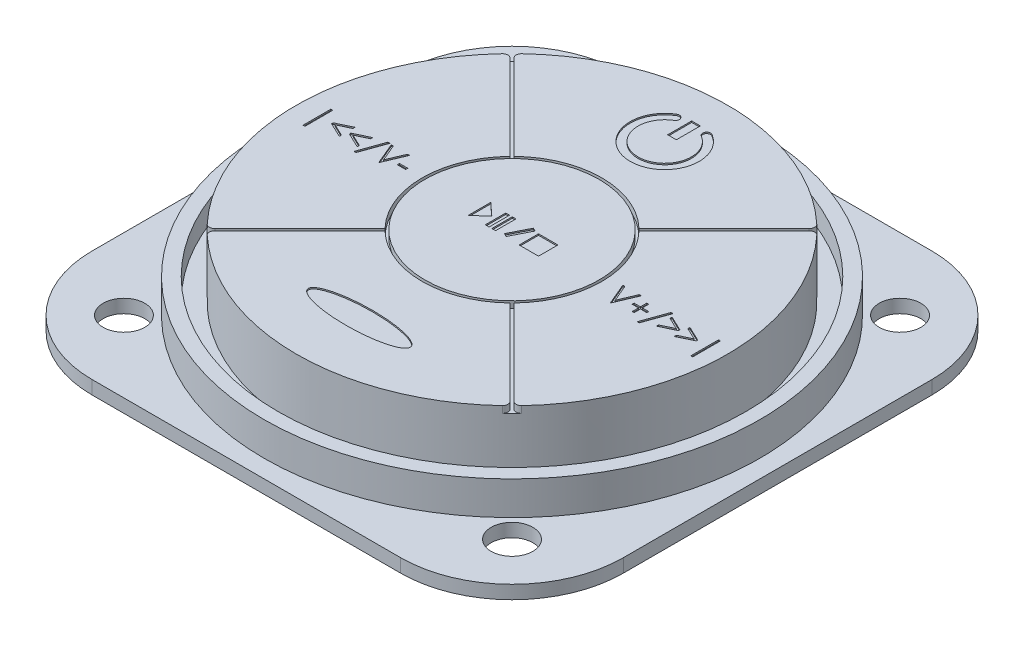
SolidWorks part; units mm, degrees
other "<Chip-PIC18F14K50>-<Imported1>"
ref_plane "Front Plane" through (0, 0, 0) normal (0, 0, 1) x (1, 0, 0)
ref_plane "Top Plane" through (0, 0, 0) normal (0, 1, 0) x (1, 0, 0)
ref_plane "Right Plane" through (0, 0, 0) normal (1, 0, 0) x (0, 0, -1)
sketch "Sketch2" plane through (0, 0, 0) normal (0, 1, 0) x (1, 0, 0)
  line L0 (-25.165, 14.6132) -> (-25.165, -14.6132)
  line L1 (-14.6132, -25.165) -> (14.6132, -25.165)
  line L2 (25.1651, -14.6132) -> (25.1651, 14.6132)
  line L3 (14.6132, 25.165) -> (-14.6132, 25.165)
  line L4 (-25.165, 0) -> (0, 0) construction
  line L5 (0, 0) -> (25.1651, 0) construction
  line L6 (0, 0) -> (0, 25.165) construction
  line L7 (0, 0) -> (0, -25.165) construction
  line L8 (-14.6132, 25.165) -> (-25.165, 14.6132) construction
  arc A0 (-25.165, -14.6132) -> (-14.6132, -25.165) centre (-14.6132, -14.6132) ccw
  arc A1 (14.6132, -25.165) -> (25.1651, -14.6132) centre (14.6132, -14.6132) ccw
  arc A2 (25.1651, 14.6132) -> (14.6132, 25.165) centre (14.6132, 14.6132) ccw
  arc A3 (-14.6132, 25.165) -> (-25.165, 14.6132) centre (-14.6132, 14.6132) ccw
  dimension "D1" = 50.3301
  dimension "D2" = 50.3301
  dimension "D3" = 14.9225
extrude "Boss-Extrude2" add sketch "Sketch2" along normal blind 1.27
sketch "Sketch9" plane through (0, 1.27, 0) normal (0, 1, 0) x (1, 0, 0)
  circle A0 centre (0, 0) radius 23.4823
  dimension "D1" = 46.9646
extrude "Boss-Extrude9" add sketch "Sketch9" along normal blind 7.0231
sketch "Sketch16" plane through (0, 8.2931, 0) normal (0, 1, 0) x (1, 0, 0)
  circle A0 centre (0, 0) radius 20.4279
  circle A1 centre (0, 0) radius 23.4823 construction
  circle A2 centre (0, 0) radius 23.4823
  dimension "D1" = 40.8559
extrude "Cut-Extrude7" cut sketch "Sketch16" against normal blind 3.8481
sketch "Sketch17" plane through (0, 4.445, 0) normal (0, 1, 0) x (1, 0, 0)
  circle A0 centre (0, 0) radius 20.4279 construction
  circle A1 centre (0, 0) radius 20.4279
  circle A2 centre (0, 0) radius 22.1615
  circle A3 centre (0, 0) radius 23.4823 construction
  dimension "D1" = 1.3208
extrude "Cut-Extrude8" cut sketch "Sketch17" against normal blind 2.032
sketch "Sketch10" plane through (0, 8.2931, 0) normal (0, 1, 0) x (1, 0, 0)
  line L0 (0, 0) -> (-6.0161, 6.0161) construction
  line L1 (0, 0) -> (6.0161, -6.0161) construction
  line L2 (0, 0) -> (6.0161, 6.0161) construction
  line L3 (0, 0) -> (-6.0161, -6.0161) construction
  line L4 (0, 0) -> (0, -8.255) construction
  line L5 (-6.0161, 6.0161) -> (-6.1059, 5.9263) construction
  line L6 (-6.0161, 6.0161) -> (-5.9263, 6.1059) construction
  line L7 (6.0161, 6.0161) -> (5.9263, 6.1059) construction
  line L8 (6.0161, 6.0161) -> (6.1059, 5.9263) construction
  line L9 (-6.0161, -6.0161) -> (-6.1059, -5.9263) construction
  line L10 (-6.0161, -6.0161) -> (-5.9263, -6.1059) construction
  line L11 (6.0161, -6.0161) -> (5.9263, -6.1059) construction
  line L12 (6.0161, -6.0161) -> (6.1059, -5.9263) construction
  line L13 (-6.1059, 5.9263) -> (-14.5343, 14.3547)
  line L14 (-5.9263, 6.1059) -> (-14.3547, 14.5343)
  line L15 (5.9263, 6.1059) -> (14.3547, 14.5343)
  line L16 (6.1059, 5.9263) -> (14.5343, 14.3547)
  line L17 (6.1059, -5.9263) -> (14.5343, -14.3547)
  line L18 (5.9263, -6.1059) -> (14.3547, -14.5343)
  line L20 (-6.1059, -5.9263) -> (-14.5343, -14.3547)
  line L21 (-5.9263, -6.1059) -> (-14.3547, -14.5343)
  circle A0 centre (0, 0) radius 20.4279 construction
  circle A1 centre (0, 0) radius 8.255
  circle A2 centre (0, 0) radius 8.509
  arc A3 (-14.5343, 14.3547) -> (-14.5343, -14.3547) centre (0, 0) ccw
  arc A4 (14.3547, 14.5343) -> (-14.3547, 14.5343) centre (0, 0) ccw
  arc A5 (14.5343, -14.3547) -> (14.5343, 14.3547) centre (0, 0) ccw
  arc A6 (-14.3547, -14.5343) -> (14.3547, -14.5343) centre (0, 0) ccw
  circle A7 centre (0, 0) radius 20.4279 construction
  circle A8 centre (0, 0) radius 20.4279
  dimension "D1" = 45
  dimension "D2" = 16.51
  dimension "D4" = 0.254
  dimension "D3" = 0.254
extrude "Cut-Extrude9" cut sketch "Sketch10" against normal blind 0.635 contours A2 L14 L13 M6 | A2 A1 | A2 L16 L15 M6 | A2 L18 L17 M6 | A2 L20 L21 M6
fillet "Fillet1" radius 0.508 8 edges at (-14.3547, 7.9756, -14.5343) (-14.5343, 7.9756, -14.3547) (14.5343, 7.9756, -14.3547) (14.3547, 7.9756, -14.5343) (14.3547, 7.9756, 14.5343) (14.5343, 7.9756, 14.3547) (-14.3547, 7.9756, 14.5343) (-14.5343, 7.9756, 14.3547)
sketch "Sketch11" plane through (0, 8.2931, 0) normal (0, 1, 0) x (1, 0, 0)
  line L0 (0, 0) -> (2.5129, 0) construction
  line L1 (1.595, 0.9179) -> (3.4308, 0.9179)
  line L2 (1.595, 0.9179) -> (1.595, -0.9179)
  line L3 (1.595, -0.9179) -> (3.4308, -0.9179)
  line L4 (3.4308, 0.9179) -> (3.4308, -0.9179)
  line L5 (1.595, 0.9179) -> (3.4308, -0.9179) construction
  line L6 (1.595, -0.9179) -> (3.4308, 0.9179) construction
  line L7 (1.2025, 0.9769) -> (0.2822, -0.841)
  line L8 (0.2822, -0.841) -> (-0.0301, -0.6829)
  line L9 (-0.0301, -0.6829) -> (0.8902, 1.135)
  line L10 (0.8902, 1.135) -> (1.2025, 0.9769)
  line L11 (-2.0739, 0.1579) -> (-3.2464, 1.2336)
  line L12 (-0.695, 1.0699) -> (-1.0454, 1.0699)
  line L13 (-0.695, 1.0699) -> (-0.695, -0.8627)
  line L14 (-0.695, -0.8627) -> (-1.0454, -0.8627)
  line L15 (-1.0454, 1.0699) -> (-1.0454, -0.8627)
  line L16 (-1.303, 1.0699) -> (-1.666, 1.0699)
  line L17 (-1.303, 1.0699) -> (-1.303, -0.8627)
  line L18 (-1.303, -0.8627) -> (-1.666, -0.8627)
  line L19 (-1.666, 1.0699) -> (-1.666, -0.8627)
  line L20 (-3.2464, 1.2336) -> (-3.2464, -0.9179)
  line L21 (-3.2464, -0.9179) -> (-2.0739, 0.1579)
  line L22 (0, 8.509) -> (0, 20.4279) construction
  line L23 (-1.2885, 16.6447) -> (0, 14.4685) construction
  line L24 (0, 14.4685) -> (1.2885, 16.6447) construction
  line L25 (1.666, 17.2822) -> (-1.666, 17.2822) construction
  line L26 (-1.666, 17.2822) -> (-1.2885, 16.6447) construction
  line L27 (1.666, 17.2822) -> (1.2885, 16.6447) construction
  line L28 (0, -8.509) -> (0, -20.4279) construction
  line L29 (-0.4103, 15.1614) -> (0.4103, 15.1614)
  line L30 (-0.4103, 15.1614) -> (-0.4103, 17.4347)
  line L31 (-0.4103, 17.4347) -> (0.4103, 17.4347)
  line L32 (0.4103, 15.1614) -> (0.4103, 17.4347)
  line L33 (-0.4103, 15.1614) -> (0.4103, 17.4347) construction
  line L34 (-0.4103, 17.4347) -> (0.4103, 15.1614) construction
  line L35 (-4.8275, -14.4685) -> (4.8275, -14.4685) construction
  arc A0 (5.9263, 6.1059) -> (-5.9263, 6.1059) centre (0, 0) ccw construction
  arc A1 (13.9769, 14.8979) -> (-13.9769, 14.8979) centre (0, 0) ccw construction
  arc A2 (-1.666, 17.2822) -> (1.666, 17.2822) centre (0, 14.4685) ccw
  arc A3 (-1.2885, 16.6447) -> (1.2885, 16.6447) centre (0, 14.4685) ccw
  arc A4 (-1.2885, 16.6447) -> (-1.666, 17.2822) centre (-1.4773, 16.9635) ccw
  arc A5 (1.666, 17.2822) -> (1.2885, 16.6447) centre (1.4773, 16.9635) ccw
  arc A6 (-5.9263, -6.1059) -> (5.9263, -6.1059) centre (0, 0) ccw construction
  arc A7 (-13.9769, -14.8979) -> (13.9769, -14.8979) centre (0, 0) ccw construction
  ellipse E0 centre (0, -14.4685) end of major axis (4.8275, -14.4685) minor radius 1.2463
  text T0 "V+/>>|" font "Century Gothic" height 2.032
  text T1 "|<</V-  " font "Century Gothic" height 2.032
  point P2 (2.5129, 0)
  point P34 (0, 16.2981)
extrude "Cut-Extrude5" cut sketch "Sketch11" against normal blind 0.127
ref_plane "Front Plane-Chip-PIC18F14K50" through (-2.235, 0, 12.415) normal (0, -1, 0) x (1, 0, 0)
ref_plane "Top Plane-Chip-PIC18F14K50" through (-2.235, 0, 12.415) normal (0, 0, 1) x (1, 0, 0)
ref_plane "Right Plane-Chip-PIC18F14K50" through (-2.235, 0, 12.415) normal (1, 0, 0) x (0, 1, 0)
inserted part "Chip-PIC18F14K50"
move or copy body "Body-Move/Copy6"
other "Distance1" parameters "D1"=6.35
other "Distance2" parameters "D1"=17.78
sketch "Sketch18" plane through (0, 1.27, 0) normal (0, 1, 0) x (1, 0, 0)
  line L0 (0, 0) -> (-18.3826, 18.3826) construction
  line L1 (0, 0) -> (18.3826, -18.3826) construction
  line L2 (0, 0) -> (18.3826, 18.3826) construction
  line L3 (0, 0) -> (-18.3826, -18.3826) construction
  line L4 (-5.9263, -6.1059) -> (-13.9886, -14.1682) construction
  line L5 (-6.1059, 5.9263) -> (-14.1682, 13.9886) construction
  line L6 (6.1059, 5.9263) -> (14.1682, 13.9886) construction
  line L7 (6.1059, -5.9263) -> (14.1682, -13.9886) construction
  circle A0 centre (0, 0) radius 25.9969 construction
  circle A1 centre (-18.3826, 18.3826) radius 1.9749
  circle A2 centre (18.3826, 18.3826) radius 1.9749
  circle A3 centre (18.3826, -18.3826) radius 1.9749
  circle A4 centre (-18.3826, -18.3826) radius 1.9749
  dimension "D1" = 51.9938
  dimension "D2" = 3.9497
extrude "Cut-Extrude10" cut sketch "Sketch18" against normal through all
